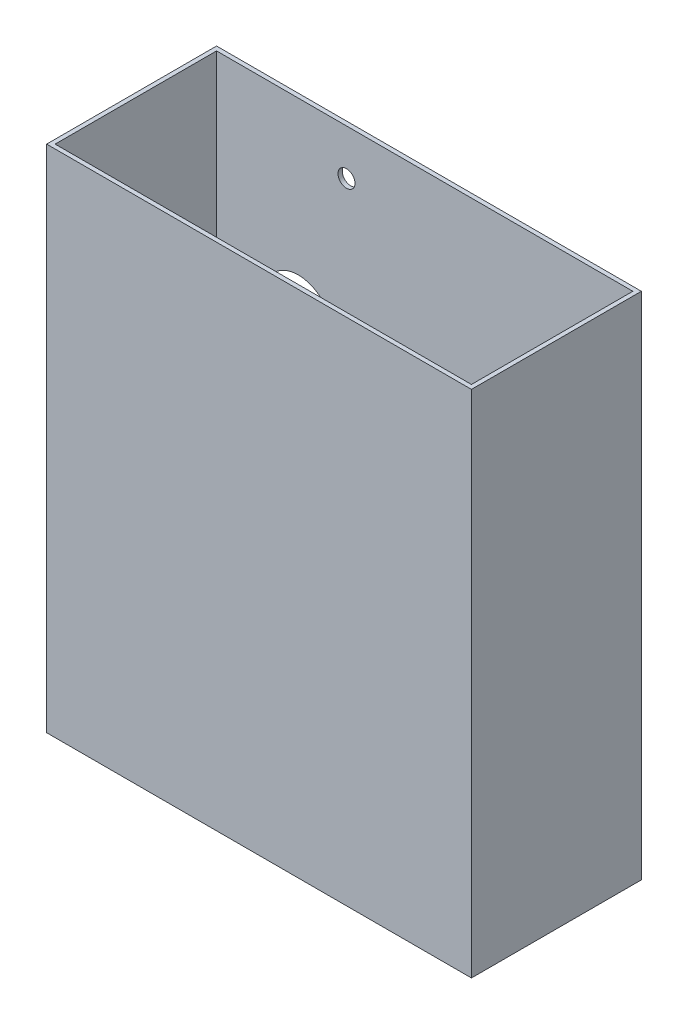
SolidWorks part; units mm, degrees
ref_plane "Front Plane" through (0, 0, 0) normal (0, 0, 1) x (1, 0, 0)
ref_plane "Top Plane" through (0, 0, 0) normal (0, 1, 0) x (1, 0, 0)
ref_plane "Right Plane" through (0, 0, 0) normal (1, 0, 0) x (0, 0, -1)
sketch "Sketch1" plane through (0, 0, 0) normal (0, 1, 0) x (1, 0, 0)
  line L1 (-63.5, 25.4) -> (63.5, 25.4)
  line L2 (-63.5, 25.4) -> (-63.5, -25.4)
  line L3 (-63.5, -25.4) -> (63.5, -25.4)
  line L4 (63.5, 25.4) -> (63.5, -25.4)
  line L5 (-63.5, 25.4) -> (63.5, -25.4) construction
  line L6 (-63.5, -25.4) -> (63.5, 25.4) construction
  point P0 (0, 0)
extrude "Boss-Extrude1" add sketch "Sketch1" along normal blind 152.4
sketch "Sketch2" plane through (0, 152.4, 0) normal (0, 1, 0) x (1, 0, 0)
  line L1 (-62.23, 24.13) -> (62.23, 24.13)
  line L2 (-62.23, 24.13) -> (-62.23, -24.13)
  line L3 (-62.23, -24.13) -> (62.23, -24.13)
  line L4 (62.23, 24.13) -> (62.23, -24.13)
  line L5 (-62.23, 24.13) -> (62.23, -24.13) construction
  line L6 (-62.23, -24.13) -> (62.23, 24.13) construction
  point P0 (0, 0)
extrude "Cut-Extrude1" cut sketch "Sketch2" against normal blind 149.86
sketch "Sketch3" plane through (0, 0, -25.4) normal (0, 0, -1) x (-1, 0, 0)
  line L0 (37.7686, 152.4) -> (37.7686, 0)
  line L1 (-63.5, 152.4) -> (63.5, 152.4) construction
  line L2 (-63.5, 0) -> (63.5, 0) construction
  circle A0 centre (37.7686, 20.362) radius 11.176
  circle A1 centre (37.7686, 58.6349) radius 10.16
  circle A2 centre (37.8026, 96.462) radius 10.16
  circle A3 centre (23.3778, 138.7937) radius 2.54
extrude "Cut-Extrude3" cut sketch "Sketch3" against normal blind 2.54 contours L0 A1 | L0 A1 | L0 A2 | L0 A2 | L0 A0 | L0 A0 | A3
